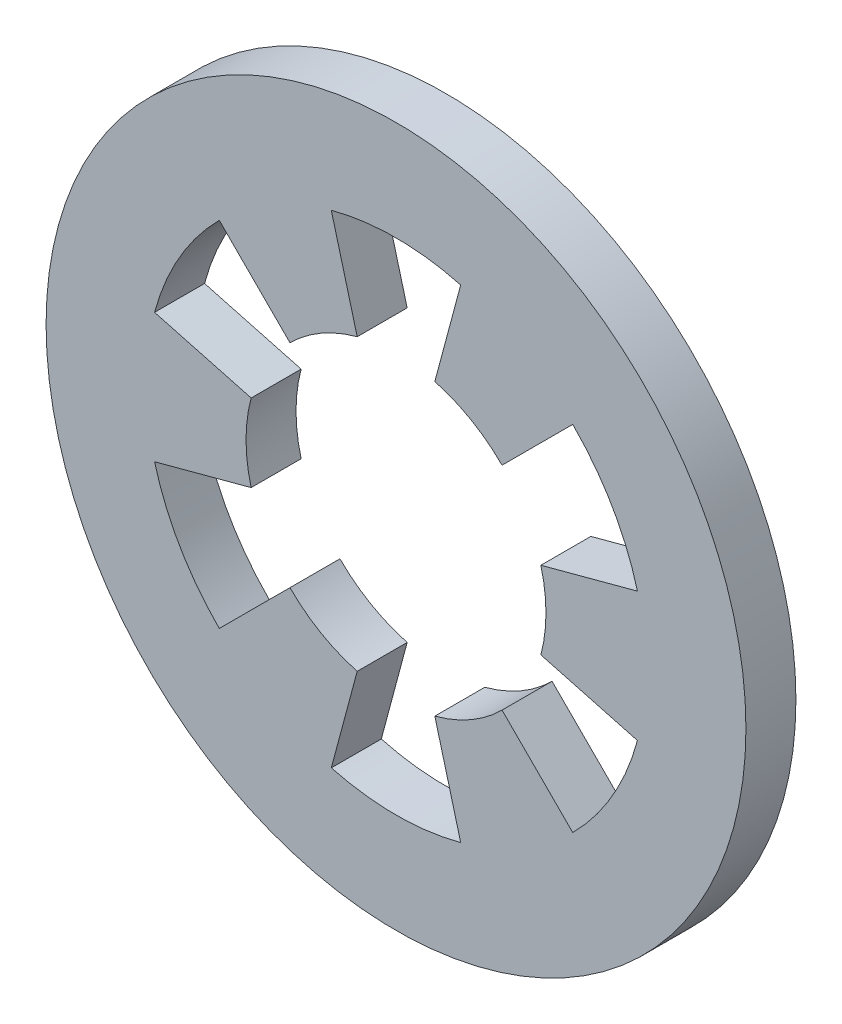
SolidWorks part; units mm, degrees
ref_plane "Plan1" through (0, 0, 0) normal (0, 0, 1) x (1, 0, 0)
ref_plane "Plan2" through (0, 0, 0) normal (0, 1, 0) x (1, 0, 0)
ref_plane "Plan3" through (0, 0, 0) normal (1, 0, 0) x (0, 0, -1)
sketch "Esquisse1" plane through (0, 0, 0) normal (0, 0, 1) x (1, 0, 0)
  line L0 (-6, 0) -> (10, 0) construction
  circle A0 centre (0, 0) radius 3.5
  circle A1 centre (0, 0) radius 1.5
  dimension "D1" = 3
  dimension "D2" = 7
extrude "Base-Extrusion" add sketch "Esquisse1" along normal blind 0.5
sketch "Esquisse2" plane through (0, 0, 0.5) normal (0, 0, 1) x (1, 0, 0)
  line L0 (1.4489, 0.3882) -> (2.4148, 0.647)
  line L1 (1.0607, 1.0607) -> (1.7678, 1.7678)
  line L2 (0, 0) -> (4, 0) construction
  circle A0 centre (0, 0) radius 1.5 construction
  arc A1 (1.4489, 0.3882) -> (1.0607, 1.0607) centre (0, 0) ccw
  arc A2 (2.4148, 0.647) -> (1.7678, 1.7678) centre (0, 0) ccw
  dimension "D1" = 5
  dimension "D2" = 30
  dimension "D3" = 15
extrude "Enlèv. mat.-Extru.1" cut sketch "Esquisse2" against normal through all
pattern_circular "Répétition circulaire1" count 6 every 60
